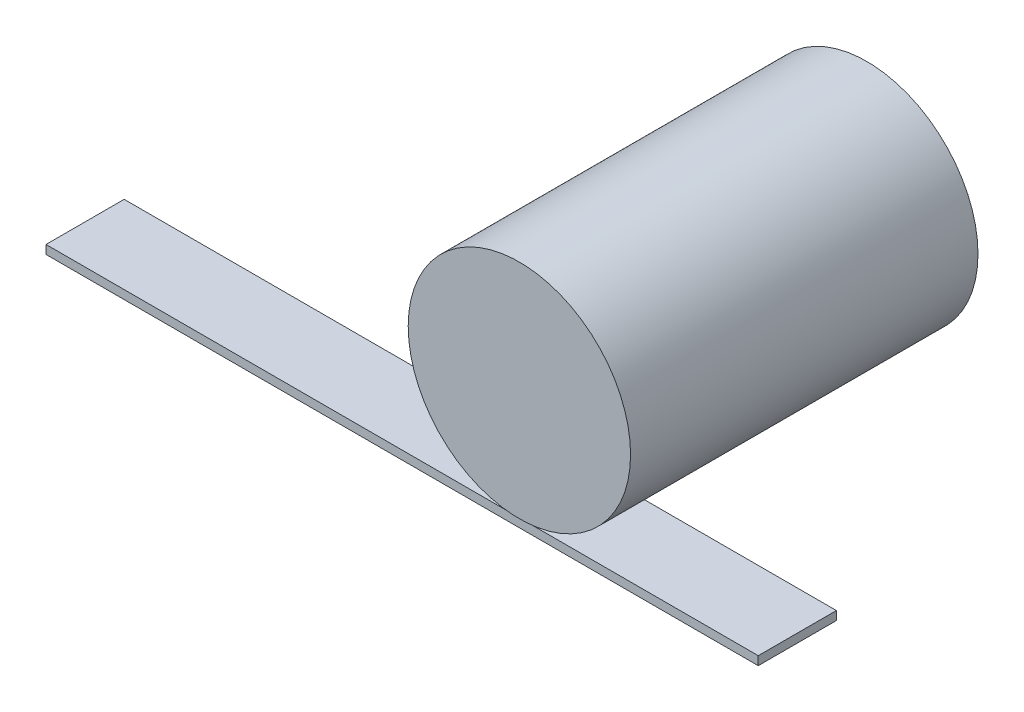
SolidWorks part; units mm, degrees
ref_plane "Plan de face" through (0, 0, 0) normal (0, 0, 1) x (1, 0, 0)
ref_plane "Plan de dessus" through (0, 0, 0) normal (0, 1, 0) x (1, 0, 0)
ref_plane "Plan de droite" through (0, 0, 0) normal (1, 0, 0) x (0, 0, -1)
sketch "Esquisse1" plane through (0, 0, 0) normal (0, 0, 1) x (1, 0, 0)
  circle A0 centre (0, 0) radius 64
  dimension "D1" = 128
extrude "Boss.-Extru.1" add sketch "Esquisse1" along normal blind 70 and the other way blind 130
ref_plane "Plan1" through (0, -91, 0) normal (0, 1, 0) x (1, 0, 0)
sketch "Esquisse2" plane through (0, -91, 0) normal (0, 1, 0) x (1, 0, 0)
  line L1 (-300, 2.5) -> (110, 2.5)
  line L2 (-300, 2.5) -> (-300, -42.5)
  line L3 (-300, -42.5) -> (110, -42.5)
  line L4 (110, 2.5) -> (110, -42.5)
  dimension "D1" = 110
  dimension "D2" = 300
  dimension "D3" = 45
  dimension "D4" = 2.5
extrude "Boss.-Extru.2" add sketch "Esquisse2" against normal blind 5 separate body
